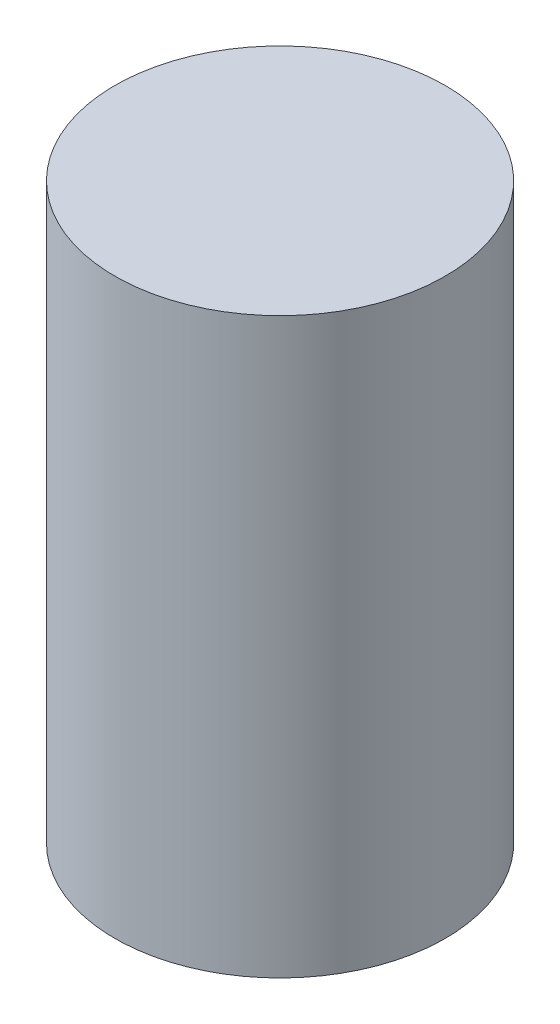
SolidWorks part; units mm, degrees
ref_plane "WL" through (0, 0, 0) normal (0, 0, 1) x (1, 0, 0)
ref_plane "BL" through (0, 0, 0) normal (0, 1, 0) x (1, 0, 0)
ref_plane "STA" through (0, 0, 0) normal (1, 0, 0) x (0, 0, -1)
sketch "Sketch1" plane through (0, 0, 0) normal (0, 1, 0) x (1, 0, 0)
  line L0 (-2.5883, 1.4859) -> (2.5883, 1.4859)
  arc A0 (-2.5883, 1.4859) -> (2.5883, 1.4859) centre (0, 0) ccw
  dimension "D1" = 5.969
  dimension "D2" = 4.4704
extrude "Boss-Extrude1" add sketch "Sketch1" along normal blind 11.938
sketch "Sketch2" plane through (0, 0, 0) normal (0, -1, 0) x (1, 0, 0)
  circle A0 centre (0, 0) radius 2.9845
  arc A2 (2.5883, -1.4859) -> (-2.5883, -1.4859) centre (0, 0) ccw construction
extrude "Boss-Extrude2" add sketch "Sketch2" along normal blind 10.3632
sketch "Sketch3" plane through (0, 0, -1.4859) normal (0, 0, -1) x (-1, 0, 0)
  line L2 (-6.743, 13.3495) -> (7.5681, 13.3495)
  line L3 (-6.743, 13.3495) -> (-6.743, 0)
  line L4 (-6.743, 0) -> (7.5681, 0)
  line L5 (7.5681, 13.3495) -> (7.5681, 0)
extrude "Cut-Extrude1" cut sketch "Sketch3" against normal through all
ref_plane "Plane2" through (0, -3.048, 0) normal (0, 1, 0) x (1, 0, 0)
sketch "Sketch6" plane through (0, -3.048, 0) normal (0, 1, 0) x (1, 0, 0)
  line L0 (0, 0) -> (0, 3.8325) construction
  line L1 (-2.4017, 3.8325) -> (0, 3.8325)
  line L2 (0, 1.4308) -> (-2.4017, 3.8325)
  line L3 (0, 3.8325) -> (0, 1.4308)
  circle A0 centre (0, 0) radius 2.9845 construction
  circle A1 centre (0, 0) radius 2.9845 construction
  point P8 (-1.27, 2.7008)
  dimension "D1" = 45
  dimension "D2" = 1.27
sketch "Sketch7" plane through (0, -3.048, 0) normal (0, 1, 0) x (1, 0, 0)
  line L0 (0, 0) -> (0, 3.646) construction
revolve "Cut-Revolve6" cut sketch "Sketch6" angle 360 about L0
